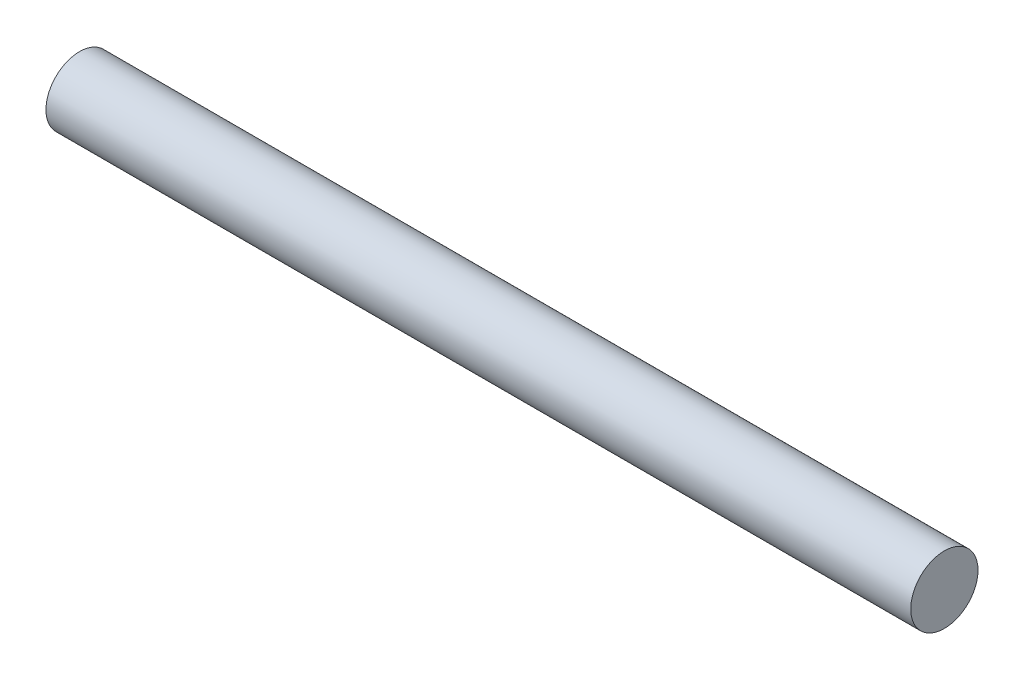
SolidWorks part; units mm, degrees
ref_plane "Front Plane" through (0, 0, 0) normal (0, 0, 1) x (1, 0, 0)
ref_plane "Top Plane" through (0, 0, 0) normal (0, 1, 0) x (1, 0, 0)
ref_plane "Right Plane" through (0, 0, 0) normal (1, 0, 0) x (0, 0, -1)
sketch "Sketch1" plane through (0, 0, 0) normal (1, 0, 0) x (0, 0, -1)
  circle A0 centre (0, 0) radius 1.4
  dimension "D1" = 2.8
extrude "Boss-Extrude2" add sketch "Sketch1" along normal blind 36
